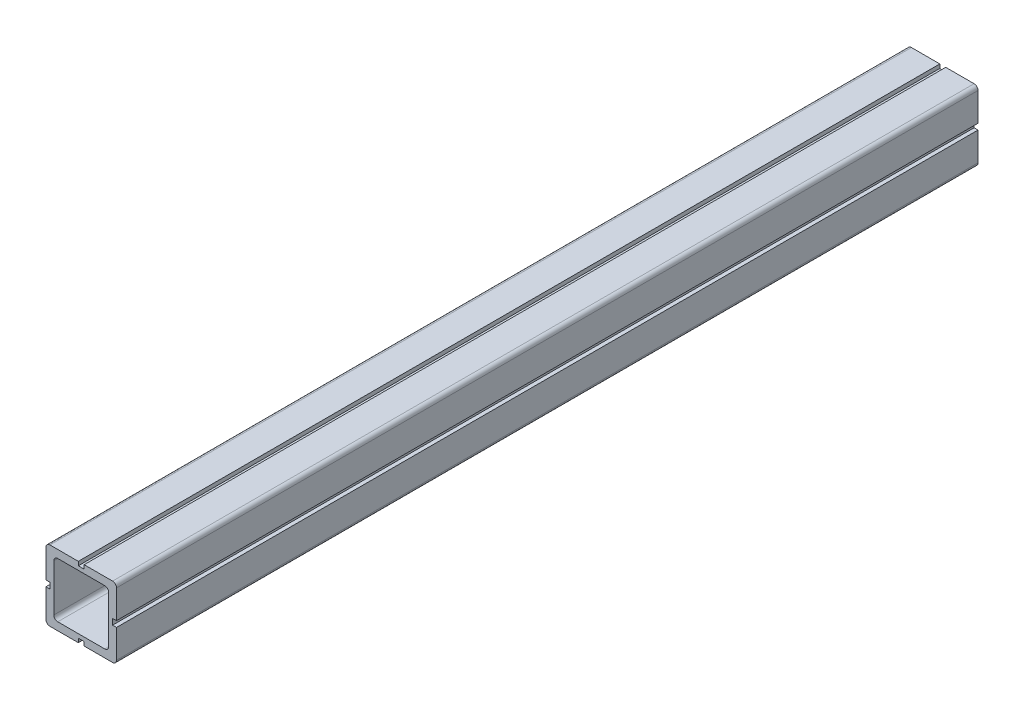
SolidWorks part; units mm, degrees
ref_plane "前视基准面" through (0, 0, 0) normal (0, 0, 1) x (1, 0, 0)
ref_plane "上视基准面" through (0, 0, 0) normal (0, 1, 0) x (1, 0, 0)
ref_plane "右视基准面" through (0, 0, 0) normal (1, 0, 0) x (0, 0, -1)
sketch "草图1" plane through (0, 0, 0) normal (0, 0, 1) x (1, 0, 0)
  line L1 (9, 9) -> (-9, 9)
  line L2 (9, 9) -> (9, -9)
  line L3 (9, -9) -> (-9, -9)
  line L4 (-9, 9) -> (-9, -9)
  line L5 (9, 9) -> (-9, -9) construction
  line L6 (9, -9) -> (-9, 9) construction
  line L7 (7, 7) -> (-7, 7)
  line L8 (7, 7) -> (7, -7)
  line L9 (7, -7) -> (-7, -7)
  line L10 (-7, 7) -> (-7, -7)
  line L11 (7, 7) -> (-7, -7) construction
  line L12 (7, -7) -> (-7, 7) construction
  point P0 (0, 0)
  point P6 (0, 0)
  dimension "D1" = 14
  dimension "D2" = 14
  dimension "D3" = 2
extrude "凸台-拉伸1" add sketch "草图1" along normal mid plane 220
fillet "圆角1" radius 1 8 edges at (9, 9, 0) (9, -9, 0) (-9, -9, 0) (-9, 9, 0) (-7, -7, 0) (7, 7, 0) (-7, 7, 0) (7, -7, 0)
sketch "草图2" plane through (0, 0, 110) normal (0, 0, 1) x (1, 0, 0)
  line L0 (8, 9) -> (-8, 9) construction
  line L1 (0.75, 10) -> (-0.75, 10)
  line L2 (0.75, 10) -> (0.75, 8)
  line L3 (0.75, 8) -> (-0.75, 8)
  line L4 (-0.75, 10) -> (-0.75, 8)
  line L5 (0.75, 10) -> (-0.75, 8) construction
  line L6 (0.75, 8) -> (-0.75, 10) construction
  line L7 (8, -0.75) -> (8, 0.75)
  line L8 (10, 0.75) -> (8, 0.75)
  line L9 (10, -0.75) -> (10, 0.75)
  line L10 (10, -0.75) -> (8, -0.75)
  line L11 (-0.75, -8) -> (0.75, -8)
  line L12 (0.75, -10) -> (0.75, -8)
  line L13 (-0.75, -10) -> (0.75, -10)
  line L14 (-0.75, -10) -> (-0.75, -8)
  line L15 (-8, 0.75) -> (-8, -0.75)
  line L16 (-10, -0.75) -> (-8, -0.75)
  line L17 (-10, 0.75) -> (-10, -0.75)
  line L18 (-10, 0.75) -> (-8, 0.75)
  point P0 (0, 9)
  point P22 (0, 0)
  dimension "D1" = 2
  dimension "D2" = 1.5
  dimension "D3" = 4
extrude "切除-拉伸1" cut sketch "草图2" against normal up to next
